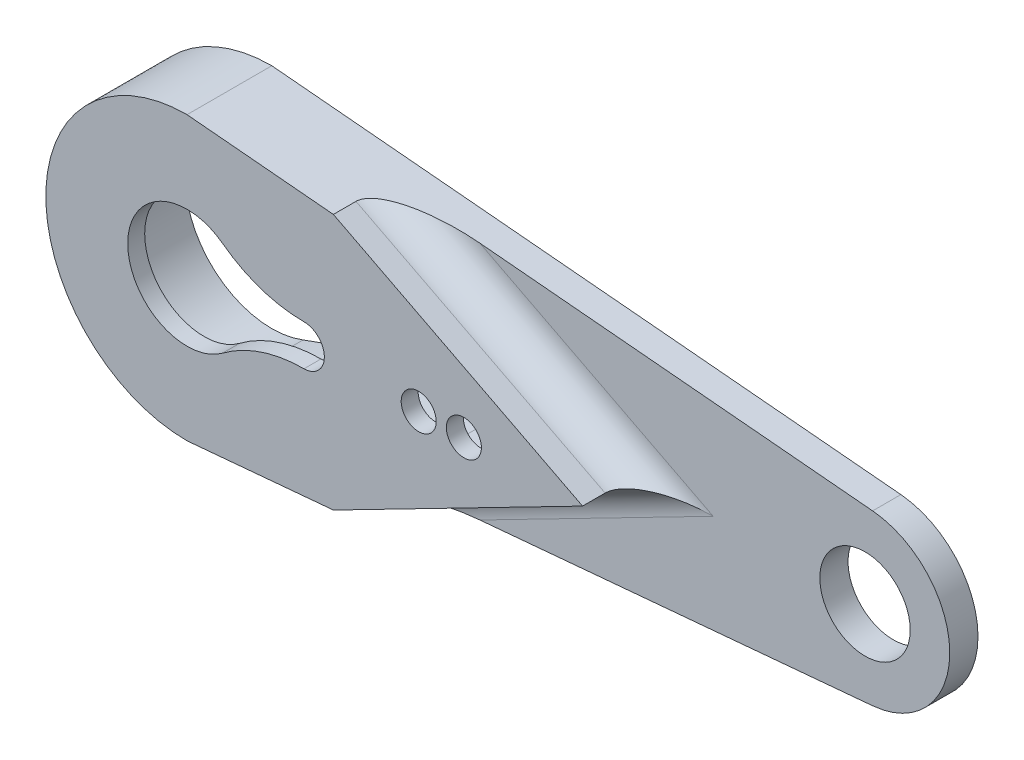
SolidWorks part; units mm, degrees
other "Marca1"
sketch "Croquis3" plane through (-12.5, 183.4486, 3.75) normal (-0.6085, 0.5443, 0.5774) x (0.706, 0.0393, 0.7071)
ref_plane "Alzado" through (0, 0, 0) normal (0, 0, 1) x (1, 0, 0)
ref_plane "Planta" through (0, 0, 0) normal (0, 1, 0) x (1, 0, 0)
ref_plane "Vista lateral" through (0, 0, 0) normal (1, 0, 0) x (0, 0, -1)
sketch "Croquis1" plane through (0, 0, 0) normal (0, 0, 1) x (1, 0, 0)
  line L0 (20.5845, 3.8) -> (24.5, 3.8)
  line L5 (50.7945, 0) -> (50050.7945, 0) construction
  line L7 (20.5845, -3.8) -> (24.5, -3.8)
  line L8 (24.5, 3.8) -> (24.5, 0) construction
  line L9 (24.5, 0) -> (24.5, -3.8) construction
  line L10 (20.5, 0) -> (24.5, 0) construction
  line L11 (0, 0) -> (0, 12.5) construction
  line L16 (0, 12.5) -> (55.6749, 7.4696)
  line L17 (55.6749, -7.4696) -> (0, -12.5)
  arc A0 (2.7649, 7.1329) -> (20.5845, 3.8) centre (20.5845, 53.1038) ccw
  arc A1 (-2.6207, 7.1871) -> (2.7649, -7.1329) centre (0, 0) ccw
  circle A2 centre (24.5, 0) radius 1.55
  circle A3 centre (0, 0) radius 62.5 construction
  arc A7 (0, 7.65) -> (2.7649, -7.1329) centre (0, 0) ccw construction
  arc A8 (55.6749, 7.4696) -> (55.6749, -7.4696) centre (55, 0) cw
  arc A10 (2.7649, 7.1329) -> (2.7649, -7.1329) centre (0, 0) ccw
  arc A11 (2.7649, -7.1329) -> (20.5845, -3.8) centre (20.5845, -53.1038) cw
  arc A12 (24.5, -3.8) -> (24.5, 3.8) centre (24.5, 0) ccw
  circle A15 centre (20.5, 0) radius 1.55
  circle A16 centre (55, 0) radius 4
  arc A17 (0, 12.5) -> (0, -12.5) centre (0, 0) ccw
  arc A18 (2.7649, -7.1329) -> (7.65, 0) centre (0, 0) ccw construction
  dimension "D2" = 4
  dimension "D4" = 24.5
  dimension "D5" = 8
  dimension "D7" = 25
  dimension "D6" = 7.5
  dimension "D8" = 7.65
  dimension "D11" = 49.3038
  dimension "D12" = 3.8
  dimension "D13" = 3.1
  dimension "D9" = 55
  dimension "D10" = 4
extrude "Saliente-Extruir1" add sketch "Croquis1" against normal mid plane 7.5
sketch "Croquis2" plane through (0, 0, 3.75) normal (0, 0, 1) x (1, 0, 0)
  line L0 (10.35, 0) -> (28.3, 0) construction
  line L1 (28.3, 172.5492) -> (28.3, -46812.032) construction
  line L2 (24.5, 3.8) -> (24.5, 0) construction
  line L3 (20.5845, 3.8) -> (24.5, 3.8) construction
  line L4 (10.35, 0) -> (10.35, 1.8) construction
  line L5 (20.5845, -3.8) -> (24.5, -3.8) construction
  line L6 (20.5845, -3.8) -> (24.5, -3.8)
  line L7 (20.5845, 3.8) -> (24.5, 3.8)
  line L8 (16.3357, 176.3036) -> (13.6687, 173.3226) construction
  line L9 (24.5, 0) -> (20.5, 0) construction
  arc A0 (3.15, 4.2) -> (3.15, -4.2) centre (0, 0) ccw
  arc A1 (3.15, 4.2) -> (10.35, 1.8) centre (10.35, 13.8) ccw
  arc A2 (3.15, -4.2) -> (10.35, -1.8) centre (10.35, -13.8) cw
  arc A3 (10.35, -1.8) -> (10.35, 1.8) centre (10.35, 0) ccw
  arc A4 (24.5, -3.8) -> (24.5, 3.8) centre (24.5, 0) ccw construction
  arc A6 (8.2425, 164.5579) -> (5.2304, 157.5918) centre (17.1857, 156.5567) ccw construction
  arc A7 (0, 12.5) -> (0, -12.5) centre (0, 0) ccw construction
  arc A8 (8.2425, 164.5579) -> (5.5595, 166.9583) centre (6.901, 165.7581) ccw construction
  arc A9 (20.5845, -3.8) -> (2.7649, -7.1329) centre (20.5845, -53.1038) ccw construction
  arc A10 (2.7649, 7.1329) -> (20.5845, 3.8) centre (20.5845, 53.1038) ccw construction
  arc A11 (2.7649, 7.1329) -> (2.7649, -7.1329) centre (0, 0) ccw construction
  arc A12 (20.5845, -3.8) -> (2.7649, -7.1329) centre (20.5845, -53.1038) ccw
  arc A13 (24.5, -3.8) -> (24.5, 3.8) centre (24.5, 0) ccw
  arc A14 (2.7649, 7.1329) -> (20.5845, 3.8) centre (20.5845, 53.1038) ccw
  arc A15 (2.7649, 7.1329) -> (2.7649, -7.1329) centre (0, 0) ccw
  circle A16 centre (20.5, 0) radius 1.55
  circle A17 centre (24.5, 0) radius 1.55
  circle A20 centre (13.6687, 173.3226) radius 1.55 construction
  circle A21 centre (16.3357, 176.3036) radius 1.55 construction
  point P24 (0, 0)
  dimension "D1" = 10.5
extrude "Saliente-Extruir2" add sketch "Croquis2" against normal blind 1.5
sketch "Croquis4" plane through (0, 0, 3.75) normal (0, 0, 1) x (1, 0, 0)
  circle A0 centre (55, 0) radius 25
  dimension "D1" = 50
extrude "Cortar-Extruir1" cut sketch "Croquis4" against normal blind 5
fillet "Redondeo1" radius 5 2 edges at (31.9232, -9.6156, 1.25) (31.9232, 9.6156, 1.25)
fillet "Redondeo2" radius 5 3 edges at (29.4202, 8.2202, -1.25) (29.4202, -8.2202, -1.25) (30, 0, -1.25)
sketch "Croquis5" plane through (0, 0, 3.75) normal (0, 0, 1) x (1, 0, 0)
  line L0 (12.9503, 11.3299) -> (35, 0)
  line L1 (0, 12.5) -> (25.9005, 10.1598) construction
  line L2 (35, 0) -> (12.9503, -11.3299)
  line L3 (25.9005, -10.1598) -> (0, -12.5) construction
  line L4 (12.9503, -11.3299) -> (38.5952, -9.0128)
  line L5 (34.5257, -9.3805) -> (55.6749, -7.4696) construction
  line L6 (12.9503, 11.3299) -> (38.5952, 9.0128)
  line L7 (55.6749, 7.4696) -> (34.5257, 9.3805) construction
  line L8 (38.5952, 9.0128) -> (38.5952, -9.0128)
  arc A0 (35.3004, 3.4534) -> (35.3004, -3.4534) centre (55, 0) ccw construction
extrude "Cortar-Extruir2" cut sketch "Croquis5" against normal blind 5
sketch "Croquis6" plane through (0, 0, 3.75) normal (0, 0, 1) x (1, 0, 0)
  line L0 (29.2088, 2.9757) -> (29.2088, -2.9757)
  line L1 (12.9503, 11.3299) -> (30.1258, 2.5045) construction
  line L2 (30.1258, -2.5045) -> (12.9503, -11.3299) construction
  line L3 (29.2088, -2.9757) -> (35, 0)
  line L4 (35, 0) -> (29.2088, 2.9757)
extrude "Saliente-Extruir3" add sketch "Croquis6" against normal up to surface (5 mm away)
fillet "Redondeo3" radius 3 2 edges at (23.9751, -5.6649, -1.25) (23.9751, 5.6649, -1.25)
